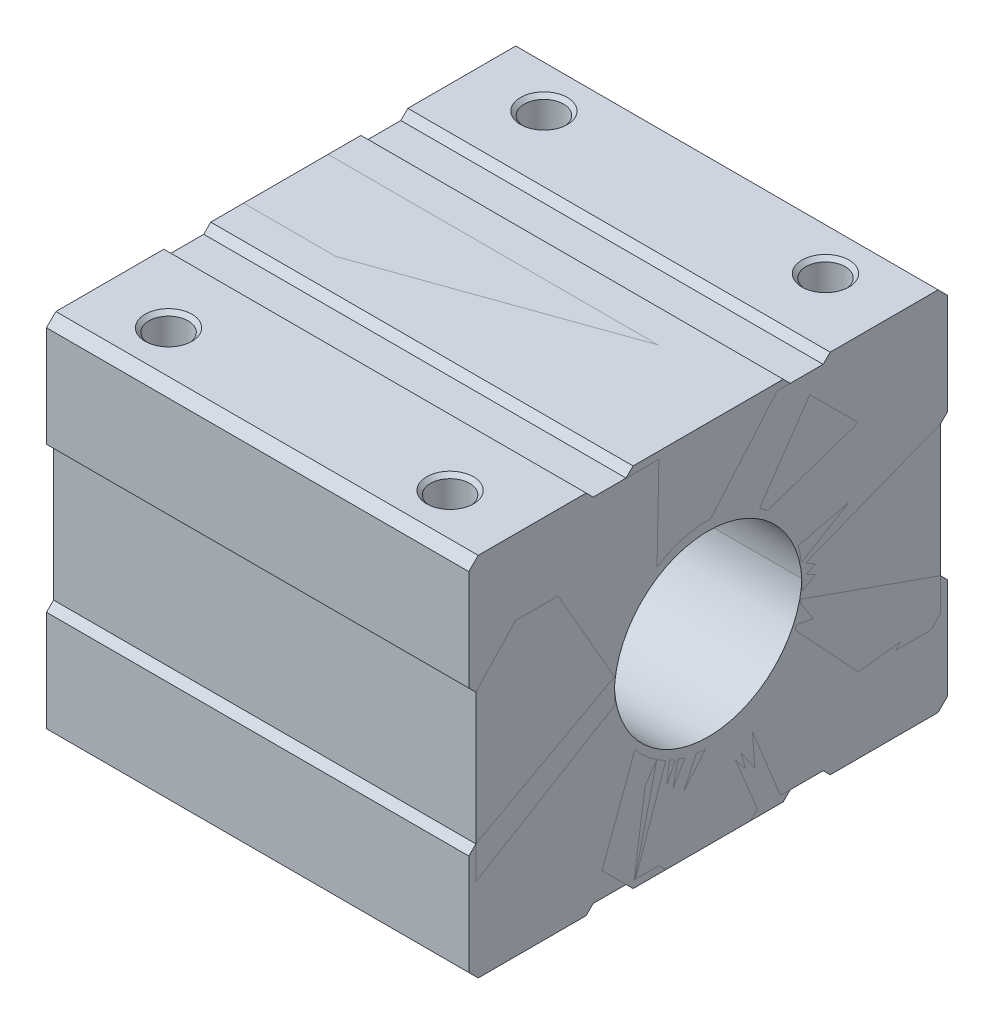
SolidWorks part; units mm, degrees
other "Solid2"
ref_plane "Front Plane" through (0, 0, 0) normal (0, 0, 1) x (1, 0, 0)
ref_plane "Top Plane" through (0, 0, 0) normal (0, 1, 0) x (1, 0, 0)
ref_plane "Right Plane" through (0, 0, 0) normal (1, 0, 0) x (0, 0, -1)
imported_body "2.7094 SCE40UU.stp<1>"
move or copy body "Body-Move/Copy1" bodies to move or copy 101 copy no rotation origin (0, 39, 0) rotation axis (1, 0, 0) rotation angle 180
